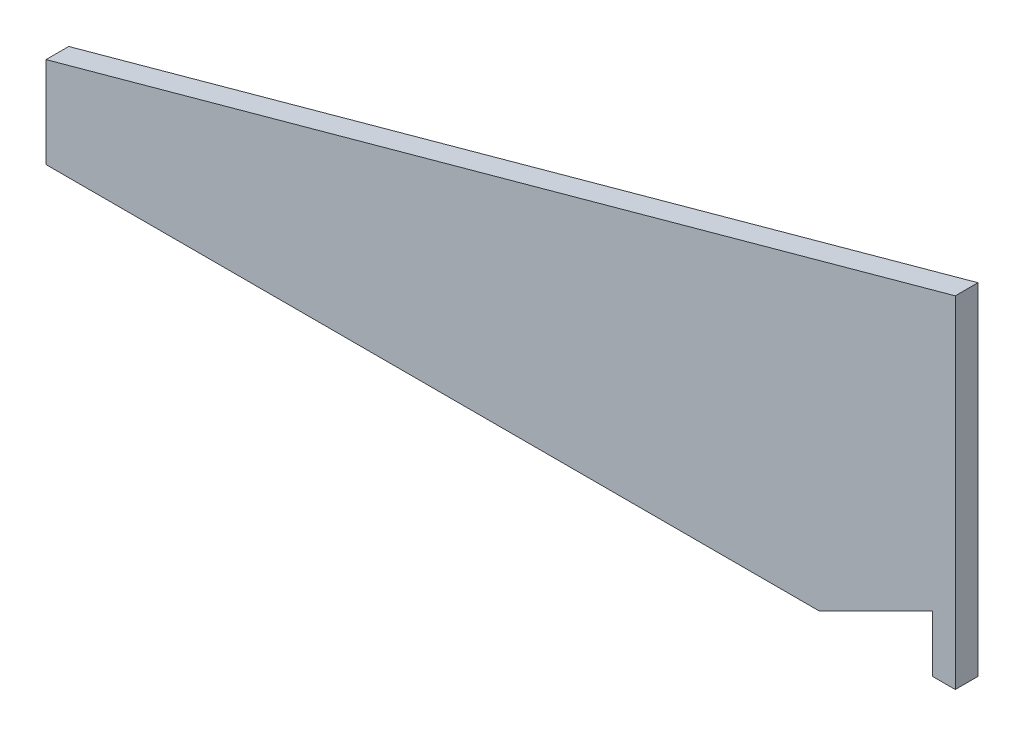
SolidWorks part; units mm, degrees
ref_plane "Front Plane" through (0, 0, 0) normal (0, 0, 1) x (1, 0, 0)
ref_plane "Top Plane" through (0, 0, 0) normal (0, 1, 0) x (1, 0, 0)
ref_plane "Right Plane" through (0, 0, 0) normal (1, 0, 0) x (0, 0, -1)
sketch "Sketch1" plane through (0, 0, 0) normal (0, 0, 1) x (1, 0, 0)
  line L0 (-31.5105, 0) -> (48.4895, 0)
  line L1 (-31.5105, 0) -> (-31.5105, 8)
  line L2 (-31.5105, 8) -> (48.4895, 30)
  line L3 (48.4895, 30) -> (48.4895, 0)
  line L4 (36.4895, 0) -> (46.4895, 5)
  line L5 (46.4895, 5) -> (46.4895, 0)
  dimension "D1" = 80
  dimension "D2" = 8
  dimension "D3" = 30
  dimension "D4" = 5
  dimension "D5" = 2
  dimension "D6" = 10
extrude "Boss-Extrude1" add sketch "Sketch1" along normal blind 2 contours L4 L5 L0 L3 L2 L1
